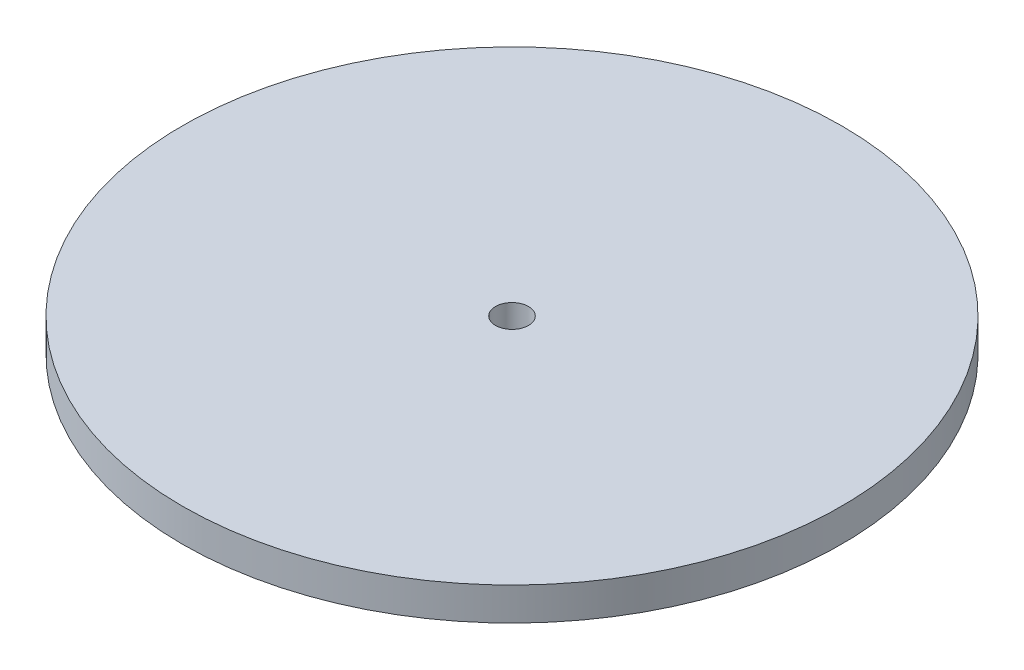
SolidWorks part; units mm, degrees
ref_plane "Front Plane" through (0, 0, 0) normal (0, 0, 1) x (1, 0, 0)
ref_plane "Top Plane" through (0, 0, 0) normal (0, 1, 0) x (1, 0, 0)
ref_plane "Right Plane" through (0, 0, 0) normal (1, 0, 0) x (0, 0, -1)
sketch "Sketch1" plane through (0, 0, 0) normal (0, 1, 0) x (1, 0, 0)
  circle A0 centre (-24.107, 6.6457) radius 63.5
  circle A1 centre (-24.107, 6.6457) radius 3.175
  dimension "D1" = 127
  dimension "D2" = 6.35
extrude "Extrude1" add sketch "Sketch1" along normal blind 6.35
